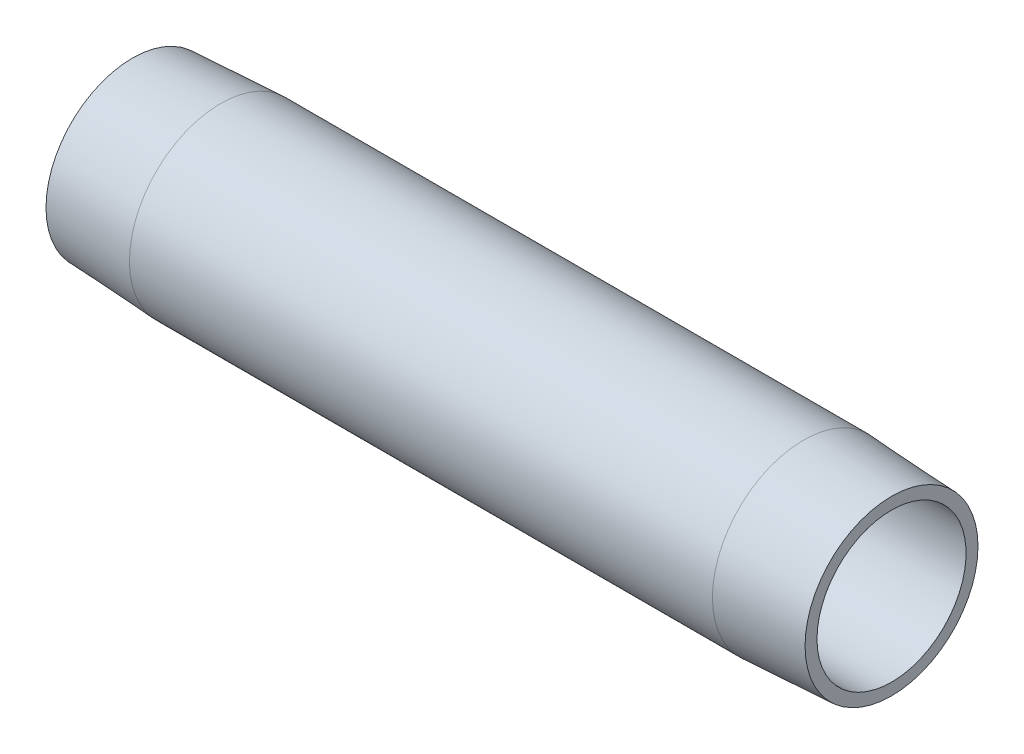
SolidWorks part; units mm, degrees
ref_plane "Front Plane" through (0, 0, 0) normal (0, 0, 1) x (1, 0, 0)
ref_plane "Top Plane" through (0, 0, 0) normal (0, 1, 0) x (1, 0, 0)
ref_plane "Right Plane" through (0, 0, 0) normal (1, 0, 0) x (0, 0, -1)
sketch "Sketch1" plane through (0, 0, 0) normal (0, 0, 1) x (1, 0, 0)
  line L6 (88.9, 8.7313) -> (0, 8.7313)
  line L7 (10.3124, 10.668) -> (0, 10.1276)
  line L8 (78.5876, 10.668) -> (10.3124, 10.668)
  line L9 (88.9, 10.1276) -> (78.5876, 10.668)
  line L10 (88.9, 8.7313) -> (88.9, 10.1276)
  line L11 (0, 10.1276) -> (0, 8.7313)
  line L12 (0, 0) -> (50000, 0) construction
  line L13 (0, -55) -> (0, 55) construction
  dimension "D1" = 88.9
  dimension "D2" = 3
  dimension "D3" = 3
  dimension "D4" = 21.336
  dimension "D5" = 17.4625
  dimension "D6" = 10.3124
  dimension "D7" = 10.3124
revolve "Revolve1" add sketch "Sketch1" angle 360 about L12
